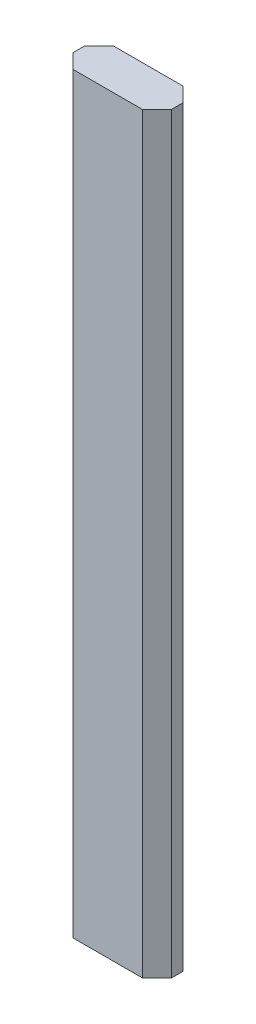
SolidWorks part; units mm, degrees
ref_plane "Front Plane" through (0, 0, 0) normal (0, 0, 1) x (1, 0, 0)
ref_plane "Top Plane" through (0, 0, 0) normal (0, 1, 0) x (1, 0, 0)
ref_plane "Right Plane" through (0, 0, 0) normal (1, 0, 0) x (0, 0, -1)
sketch "Sketch1" plane through (0, 0, 0) normal (0, 1, 0) x (1, 0, 0)
  line L0 (-111.7499, 57.103) -> (-94.7499, 57.103)
  line L1 (-94.7499, 57.103) -> (-94.7499, 50.103)
  line L2 (-94.7499, 50.103) -> (-111.7499, 50.103)
  line L3 (-111.7499, 50.103) -> (-111.7499, 57.103)
extrude "Boss-Extrude1" add sketch "Sketch1" along normal blind 130
sketch "Sketch3" plane through (0, 0, 0) normal (0, -1, 0) x (1, 0, 0)
  line L3 (-109.2499, -55.603) -> (-97.2499, -55.603)
  line L6 (-103.2499, -53.603) -> (-103.2499, -51.603)
  line L7 (-103.2499, -53.603) -> (-97.2499, -53.603)
  line L8 (-109.2499, -55.603) -> (-109.2499, -51.603)
  line L9 (-109.2499, -51.603) -> (-97.2499, -51.603)
  line L10 (-97.2499, -55.603) -> (-97.2499, -51.603)
  line L11 (-109.2499, -55.603) -> (-97.2499, -51.603) construction
  line L12 (-109.2499, -51.603) -> (-97.2499, -55.603) construction
extrude "Cut-Extrude1" cut sketch "Sketch3" against normal blind 120 contours L3 L10 L7 L6 L9 L8 | L7 L10 L9 L6
chamfer "Chamfer1" distance 2.5 angle 45 4 edges at (-111.7499, 65, -50.103) (-111.7499, 65, -57.103) (-94.7499, 65, -57.103) (-94.7499, 65, -50.103)
